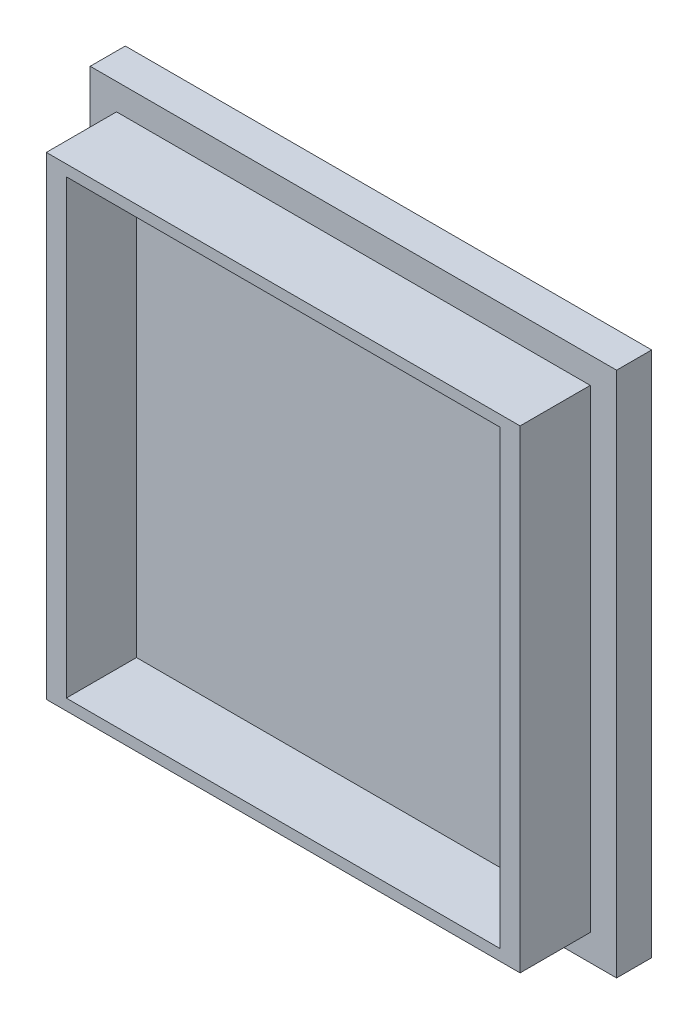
SolidWorks part; units mm, degrees
ref_plane "Front Plane" through (0, 0, 0) normal (0, 0, 1) x (1, 0, 0)
ref_plane "Top Plane" through (0, 0, 0) normal (0, 1, 0) x (1, 0, 0)
ref_plane "Right Plane" through (0, 0, 0) normal (1, 0, 0) x (0, 0, -1)
sketch "Sketch1" plane through (0, 0, 0) normal (0, 0, 1) x (1, 0, 0)
  line L1 (-19.05, 19.05) -> (19.05, 19.05)
  line L2 (-19.05, 19.05) -> (-19.05, -19.05)
  line L3 (-19.05, -19.05) -> (19.05, -19.05)
  line L4 (19.05, 19.05) -> (19.05, -19.05)
  line L5 (-19.05, 19.05) -> (19.05, -19.05) construction
  line L6 (-19.05, -19.05) -> (19.05, 19.05) construction
  point P0 (0, 0)
extrude "Boss-Extrude1" add sketch "Sketch1" along normal blind 2.54
sketch "Sketch2" plane through (0, 0, 2.54) normal (0, 0, 1) x (1, 0, 0)
  line L1 (-17.145, 17.145) -> (17.145, 17.145)
  line L2 (-17.145, 17.145) -> (-17.145, -17.145)
  line L3 (-17.145, -17.145) -> (17.145, -17.145)
  line L4 (17.145, 17.145) -> (17.145, -17.145)
  line L5 (-17.145, 17.145) -> (17.145, -17.145) construction
  line L6 (-17.145, -17.145) -> (17.145, 17.145) construction
  line L7 (-15.6994, 16.3395) -> (15.6994, 16.3395)
  line L8 (-15.6994, 16.3395) -> (-15.6994, -16.3395)
  line L9 (-15.6994, -16.3395) -> (15.6994, -16.3395)
  line L10 (15.6994, 16.3395) -> (15.6994, -16.3395)
  line L11 (-15.6994, 16.3395) -> (15.6994, -16.3395) construction
  line L12 (-15.6994, -16.3395) -> (15.6994, 16.3395) construction
  point P0 (0, 0)
  point P6 (0, 0)
extrude "Boss-Extrude3" add sketch "Sketch2" along normal blind 5.08
